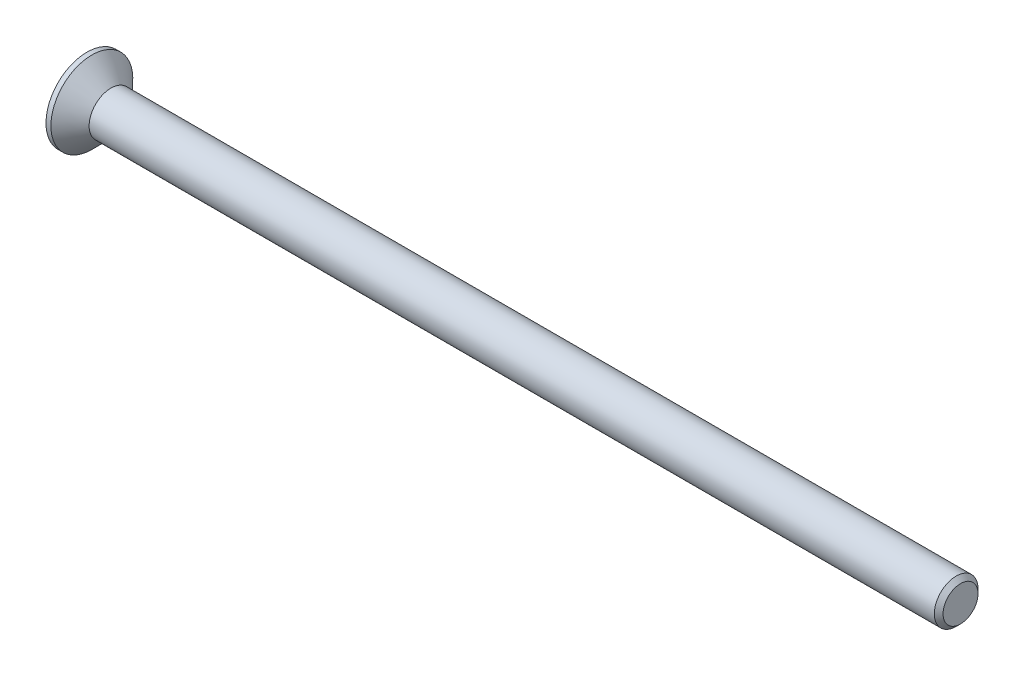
SolidWorks part; units mm, degrees
ref_plane "Front Plane" through (0, 0, 0) normal (0, 0, 1) x (1, 0, 0)
ref_plane "Top Plane" through (0, 0, 0) normal (0, 1, 0) x (1, 0, 0)
ref_plane "Right Plane" through (0, 0, 0) normal (1, 0, 0) x (0, 0, -1)
sketch "Sketch1" plane through (0, 0, 0) normal (0, 0, 1) x (1, 0, 0)
  line L1 (-2.2, 3.75) -> (-2.2, 0)
  line L2 (-2.2, 0) -> (77.8, 0)
  line L3 (77.8, 0) -> (77.8, 2)
  line L4 (77.8, 2) -> (0, 2)
  line L5 (-2.2, 3.75) -> (-1.75, 3.75)
  line L6 (-1.75, 3.75) -> (0, 2)
  dimension "D1" = 2
  dimension "D2" = 45
  dimension "D3" = 2.2
  dimension "D4" = 80
  dimension "D5" = 3.75
revolve "Revolve1" add sketch "Sketch1" angle 360 about L2
chamfer "Chamfer1" distance 0.4 angle 45 1 edges at (77.8, -2, 0)
sketch "Sketch2" plane through (-2.2, 0, 0) normal (-1, 0, 0) x (0, 0, 1)
  line L0 (-0.55, 2.2) -> (0.55, 2.2)
  line L1 (0.55, 2.2) -> (0.55, 0.55)
  line L2 (0.55, 0.55) -> (2.2, 0.55)
  line L3 (2.2, 0.55) -> (2.2, -0.55)
  line L4 (2.2, -0.55) -> (0.55, -0.55)
  line L5 (0.55, -0.55) -> (0.55, -2.2)
  line L6 (0.55, -2.2) -> (-0.55, -2.2)
  line L7 (-0.55, -2.2) -> (-0.55, -0.55)
  line L8 (-0.55, -0.55) -> (-2.2, -0.55)
  line L9 (-2.2, -0.55) -> (-2.2, 0.55)
  line L10 (-2.2, 0.55) -> (-0.55, 0.55)
  line L11 (-0.55, 0.55) -> (-0.55, 2.2)
  point P2 (0, 2.2)
  point P14 (0, -2.2)
  point P15 (2.2, 0)
  point P16 (-2.2, 0)
  dimension "D1" = 4.4
  dimension "D2" = 1.1
extrude "Cut-Extrude1" cut sketch "Sketch2" against normal blind 1.9
